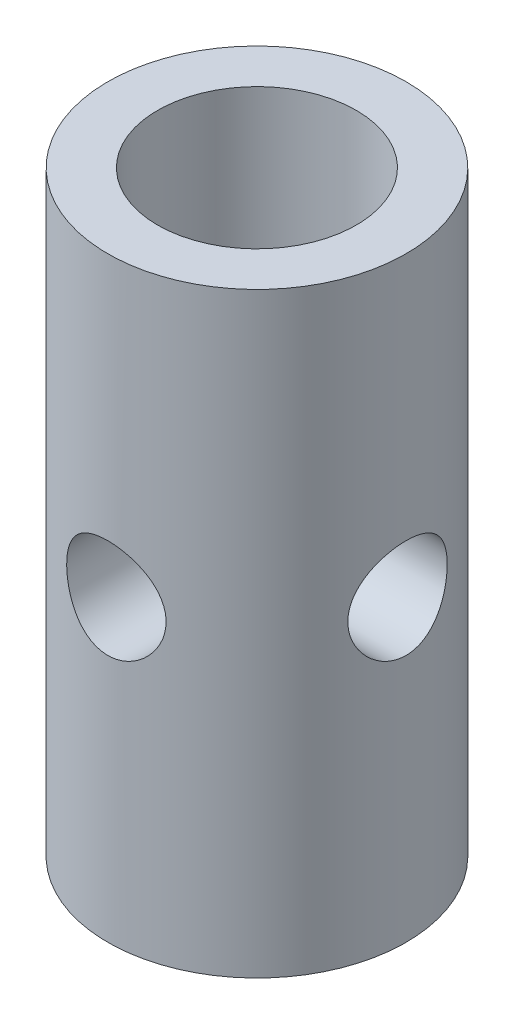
SolidWorks part; units mm, degrees
ref_plane "Plan de face" through (0, 0, 0) normal (0, 0, 1) x (1, 0, 0)
ref_plane "Plan de dessus" through (0, 0, 0) normal (0, 1, 0) x (1, 0, 0)
ref_plane "Plan de droite" through (0, 0, 0) normal (1, 0, 0) x (0, 0, -1)
sketch "Esquisse1" plane through (0, 0, 0) normal (0, 0, 1) x (1, 0, 0)
  line L0 (0, -11.8223) -> (0, 37.6165) construction
  line L2 (0, 0) -> (-7.5, 0)
  line L3 (0, 0) -> (0, 30)
  line L4 (0, 30) -> (-7.5, 30)
  line L5 (-7.5, 0) -> (-7.5, 30)
  dimension "D1" = 30
  dimension "D2" = 15
revolve "Révolution1" add sketch "Esquisse1" angle 360 about L0
sketch "Esquisse2" plane through (0, 30, 0) normal (0, 1, 0) x (1, 0, 0)
  circle A0 centre (0, 0) radius 5
  dimension "D1" = 10
extrude "Enlèv. mat.-Extru.1" cut sketch "Esquisse2" against normal blind 12
sketch "Esquisse3" plane through (0, 0, 0) normal (0, 0, 1) x (1, 0, 0)
  line L0 (-7.5, 0) -> (7.5, 0) construction
  circle A0 centre (0, 15) radius 2.5
  dimension "D2" = 5
  dimension "D1" = 15
extrude "Enlèv. mat.-Extru.2" cut sketch "Esquisse3" against normal through all and the other way through all
sketch "Esquisse4" plane through (0, 0, 0) normal (1, 0, 0) x (0, 0, -1)
  line L0 (-7.5, 0) -> (7.5, 0) construction
  circle A0 centre (0, 15) radius 2.5
  dimension "D1" = 15
  dimension "D2" = 5
extrude "Enlèv. mat.-Extru.3" cut sketch "Esquisse4" against normal through all and the other way through all
sketch "Esquisse5" plane through (0, 0, 0) normal (0, -1, 0) x (1, 0, 0)
  circle A0 centre (0, 0) radius 2.5
  dimension "D1" = 5
extrude "Enlèv. mat.-Extru.4" cut sketch "Esquisse5" against normal through all
